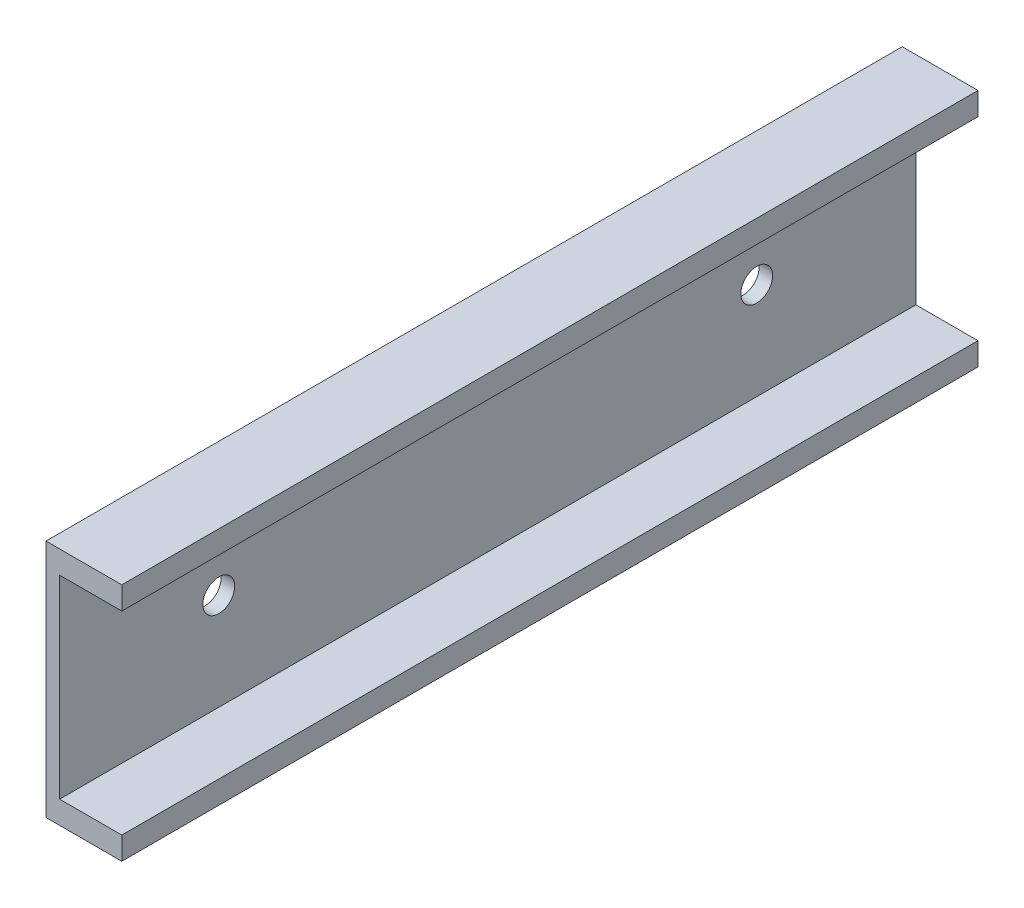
SolidWorks part; units mm, degrees
ref_plane "前视基准面" through (0, 0, 0) normal (0, 0, 1) x (1, 0, 0)
ref_plane "上视基准面" through (0, 0, 0) normal (0, 1, 0) x (1, 0, 0)
ref_plane "右视基准面" through (0, 0, 0) normal (1, 0, 0) x (0, 0, -1)
sketch "草图1" plane through (0, 0, 0) normal (0, 0, 1) x (1, 0, 0)
  line L0 (0, 0) -> (5, 0)
  line L1 (0, 0) -> (0, 15.8)
  line L2 (5, 0) -> (5, 15.8)
  line L3 (0, 15.8) -> (5, 15.8)
  line L4 (0.9, 14.3) -> (5, 14.3)
  line L5 (0.9, 14.3) -> (0.9, 1.5)
  line L6 (5, 14.3) -> (5, 1.5)
  line L7 (0.9, 1.5) -> (5, 1.5)
  dimension "D1" = 5
  dimension "D2" = 15.8
  dimension "D3" = 1.5
  dimension "D4" = 1.5
  dimension "D5" = 0.9
extrude "凸台-拉伸1" add sketch "草图1" along normal blind 56.5 contours L7 L5 L4 L2 L3 L1 L0
sketch "草图2" plane through (0.9, 0, 0) normal (1, 0, 0) x (0, 0, -1)
  line L0 (-56.5, 7.9) -> (0, 7.9)
  line L4 (0, 1.5) -> (0, 14.3)
  line L5 (0, 14.3) -> (-56.5, 14.3)
  line L6 (-56.5, 14.3) -> (-56.5, 1.5)
  line L7 (-56.5, 1.5) -> (0, 1.5)
  line L8 (0, 1.5) -> (0, 14.3)
  line L9 (0, 14.3) -> (-56.5, 14.3)
  line L10 (-56.5, 14.3) -> (-56.5, 1.5)
  line L11 (-56.5, 1.5) -> (0, 1.5)
  circle A0 centre (-46, 7.9) radius 1.05
  circle A1 centre (-10.5, 7.9) radius 1.05
  dimension "D2" = 2.1
  dimension "D3" = 10.5
  dimension "D4" = 10.5
  dimension "D1" = 0
extrude "切除-拉伸1" cut sketch "草图2" against normal through all contours A0 | A1
